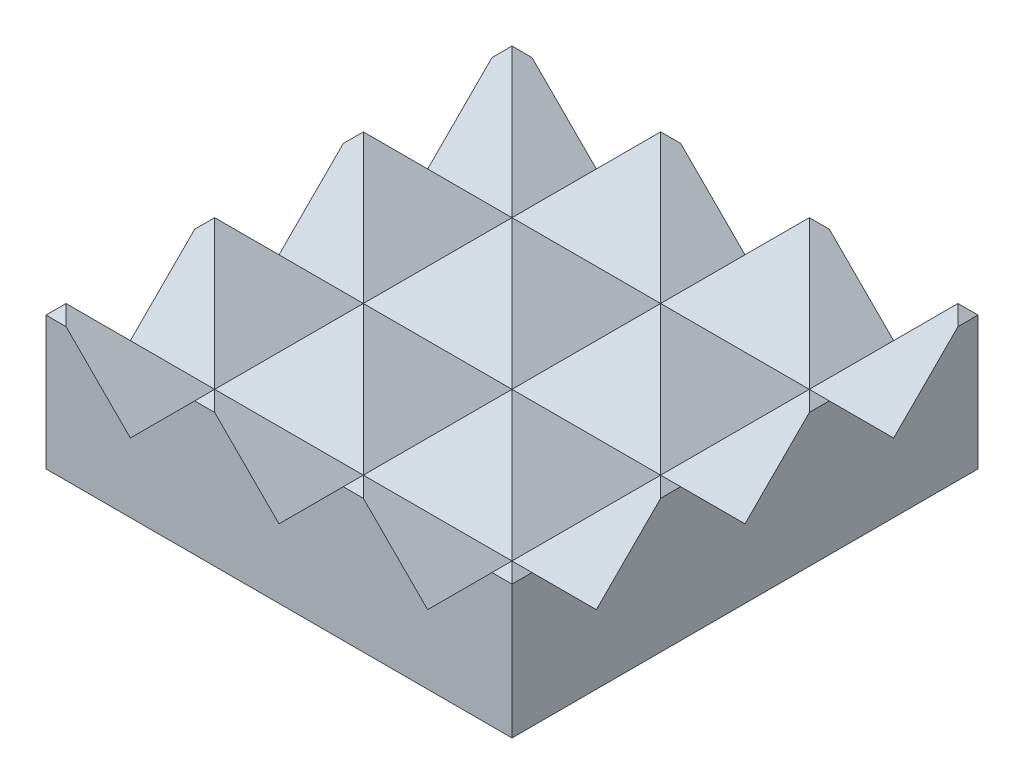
SolidWorks part; units mm, degrees
ref_plane "Front Plane" through (0, 0, 0) normal (0, 0, 1) x (1, 0, 0)
ref_plane "Top Plane" through (0, 0, 0) normal (0, 1, 0) x (1, 0, 0)
ref_plane "Right Plane" through (0, 0, 0) normal (1, 0, 0) x (0, 0, -1)
sketch "Sketch1" plane through (0, 0, 0) normal (0, 1, 0) x (1, 0, 0)
  line L0 (-4.765, -4.765) -> (-4.765, 4.765)
  line L1 (0, 0) -> (0, 50000) construction
  line L2 (0, 0) -> (50000, 0) construction
  line L3 (-4.765, 4.765) -> (4.765, 4.765)
  line L4 (4.765, -4.765) -> (4.765, 4.765)
  line L5 (-4.765, -4.765) -> (4.765, -4.765)
  point P10 (0, 4.765)
  point P11 (4.765, 0)
  point P12 (-4.765, 0)
  dimension "D1" = 9.53
  dimension "D2" = 9.53
extrude "Extrude1" add sketch "Sketch1" along normal mid plane 3.18
sketch "Sketch2" plane through (0, 0, 4.765) normal (0, 0, 1) x (1, 0, 0)
  line L0 (-6.08, 1.59) -> (-7.6, 1.59)
  line L1 (-7.6, 1.59) -> (-6.08, 0.07)
  line L2 (-4.765, -1.59) -> (4.765, -1.59) construction
  line L3 (-6.08, 0.07) -> (-4.56, 1.59)
  line L5 (-4.56, 1.59) -> (-6.08, 1.59)
  line L10 (-4.765, 1.59) -> (-4.765, -1.59) construction
  dimension "D1" = 3.04
  dimension "D2" = 2.835
  dimension "D3" = 3.18
extrude "Extrude3" cut sketch "Sketch2" against normal through all
pattern_linear "LPattern2" count 5 spacing 3.04 along (0.7071, -0.7071, 0) of "Extrude3"
sketch "Sketch3" plane through (4.765, 0, 0) normal (1, 0, 0) x (0, 0, -1)
  line L0 (-6.08, 1.59) -> (-4.56, 1.59)
  line L2 (-4.56, 1.59) -> (-6.08, 0.07)
  line L3 (-6.08, 0.07) -> (-7.6, 1.59)
  line L4 (-7.6, 1.59) -> (-6.08, 1.59)
  line L5 (-4.765, 1.385) -> (-4.765, -1.59) construction
  line L6 (7.94, 0.49) -> (-7.94, 0.49) construction
  line L8 (-4.765, -1.59) -> (4.765, -1.59) construction
  dimension "D1" = 3.04
  dimension "D2" = 2.835
  dimension "D3" = 3.18
extrude "Extrude4" cut sketch "Sketch3" against normal through all
pattern_linear "LPattern3" count 5 spacing 3.04 along (0, -0.7071, -0.7071) of "Extrude4"
chamfer "Chamfer1" distance 0.25 angle 45 4 edges at (-4.765, -1.59, 0) (0, -1.59, -4.765) (4.765, -1.59, 0) (0, -1.59, 4.765)
equation "\"D2@Sketch1\" = \"D1@Sketch1\""
equation "\"D1@Sketch3\" = \"D1@Sketch2\""
equation "\"D2@Sketch3\" = \"D2@Sketch2\""
equation "\"D3@Sketch3\" = \"D1@Extrude1\""
equation "\"D3@Sketch2\" = \"D1@Extrude1\""
